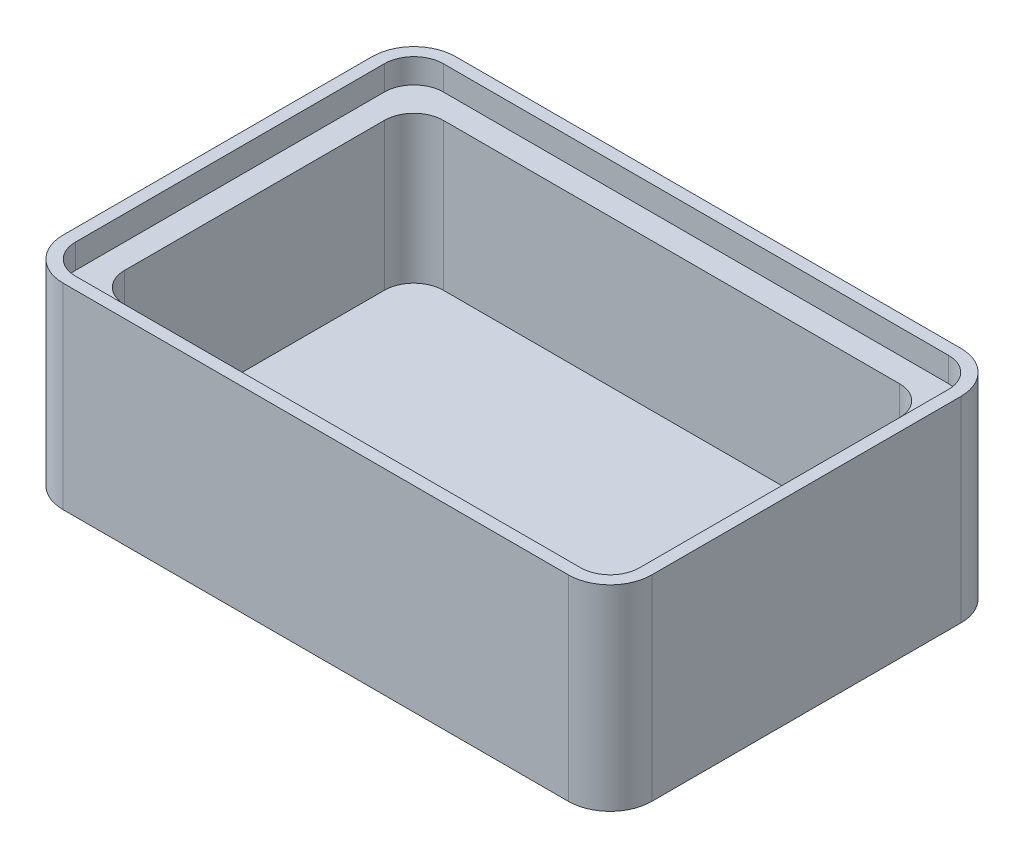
SolidWorks part; units mm, degrees
ref_plane "Front Plane" through (0, 0, 0) normal (0, 0, 1) x (1, 0, 0)
ref_plane "Top Plane" through (0, 0, 0) normal (0, 1, 0) x (1, 0, 0)
ref_plane "Right Plane" through (0, 0, 0) normal (1, 0, 0) x (0, 0, -1)
sketch "Sketch1" plane through (0, 0, 0) normal (0, 1, 0) x (1, 0, 0)
  line L0 (-76.2, -50.8) -> (76.2, 50.8) construction
  line L1 (-76.2, 50.8) -> (76.2, 50.8)
  line L2 (-76.2, 50.8) -> (-76.2, -50.8)
  line L3 (-76.2, -50.8) -> (76.2, -50.8)
  line L4 (76.2, 50.8) -> (76.2, -50.8)
  dimension "D1" = 152.4
  dimension "D2" = 101.6
extrude "Extrude1" add sketch "Sketch1" along normal blind 50.8
sketch "Sketch2" plane through (0, 50.8, 0) normal (0, 1, 0) x (-1, 0, 0)
  line L8 (66.675, -41.275) -> (66.675, 41.275)
  line L9 (66.675, 41.275) -> (-66.675, 41.275)
  line L10 (-66.675, 41.275) -> (-66.675, -41.275)
  line L11 (-66.675, -41.275) -> (66.675, -41.275)
  line L12 (66.675, -41.275) -> (66.675, 41.275)
  line L13 (66.675, 41.275) -> (-66.675, 41.275)
  line L14 (-66.675, 41.275) -> (-66.675, -41.275)
  line L15 (-66.675, -41.275) -> (66.675, -41.275)
  dimension "D1" = 9.525
extrude "Cut-Extrude1" cut sketch "Sketch2" against normal blind 44.45
sketch "Sketch3" plane through (0, 50.8, 0) normal (0, 1, 0) x (-1, 0, 0)
  line L8 (73.025, -47.625) -> (73.025, 47.625)
  line L9 (73.025, 47.625) -> (-73.025, 47.625)
  line L10 (-73.025, 47.625) -> (-73.025, -47.625)
  line L11 (-73.025, -47.625) -> (73.025, -47.625)
  line L12 (73.025, -47.625) -> (73.025, 47.625)
  line L13 (73.025, 47.625) -> (-73.025, 47.625)
  line L14 (-73.025, 47.625) -> (-73.025, -47.625)
  line L15 (-73.025, -47.625) -> (73.025, -47.625)
  dimension "D1" = 3.175
extrude "Cut-Extrude2" cut sketch "Sketch3" against normal blind 6.35
fillet "Fillet1" radius 7.62 8 edges at (73.025, 47.625, 47.625) (-73.025, 47.625, 47.625) (73.025, 47.625, -47.625) (-73.025, 47.625, -47.625) (-66.675, 25.4, 41.275) (66.675, 25.4, 41.275) (66.675, 25.4, -41.275) (-66.675, 25.4, -41.275)
fillet "Fillet2" radius 10.795 4 edges at (76.2, 25.4, 50.8) (-76.2, 25.4, 50.8) (-76.2, 25.4, -50.8) (76.2, 25.4, -50.8)
